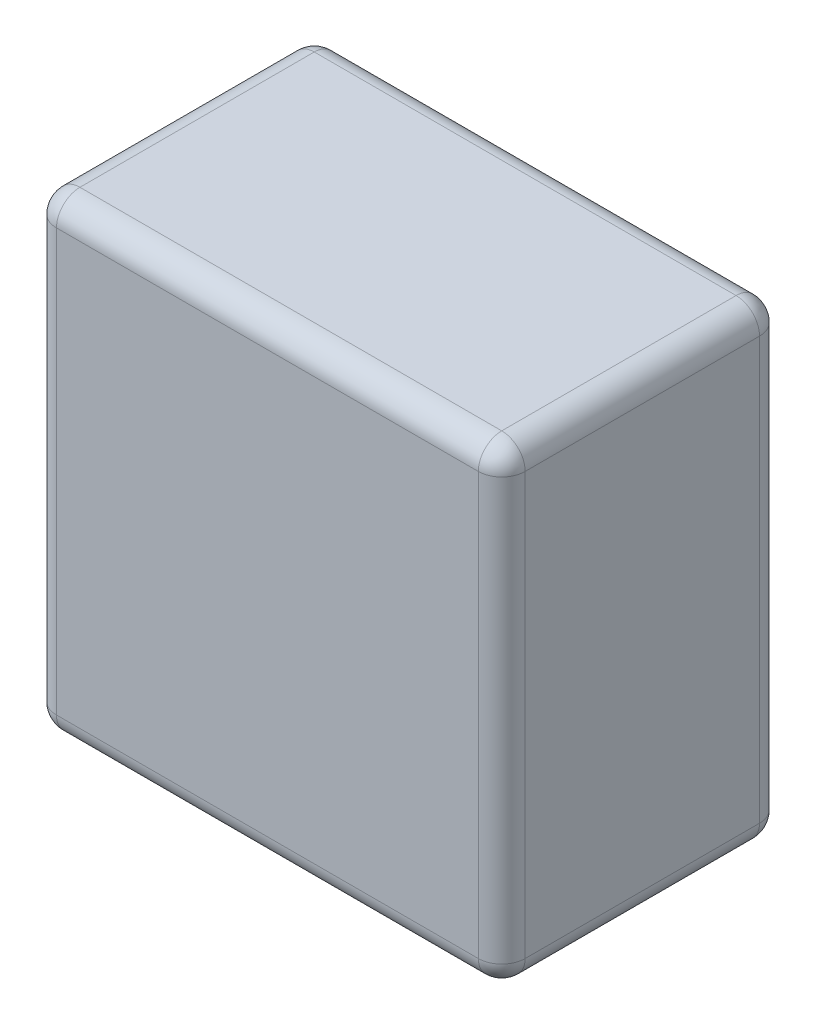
SolidWorks part; units mm, degrees
ref_plane "Front" through (0, 0, 0) normal (0, 0, 1) x (1, 0, 0)
ref_plane "Top" through (0, 0, 0) normal (0, 1, 0) x (1, 0, 0)
ref_plane "Right" through (0, 0, 0) normal (1, 0, 0) x (0, 0, -1)
sketch "Esquisse1" plane through (0, 0, 0) normal (0, 0, 1) x (1, 0, 0)
  line L4 (30, 10) -> (50, 10)
  line L5 (30, 10) -> (30, -10)
  line L6 (30, -10) -> (50, -10)
  line L7 (50, 10) -> (50, -10)
  line L8 (30, 10) -> (50, -10) construction
  line L9 (30, -10) -> (50, 10) construction
  point P1 (40, 0)
  dimension "D2" = 20
extrude "Boss.-Extru.1" add sketch "Esquisse1" along normal blind 12 contours L4 L7 L6 L5
fillet "Congé1" radius 1 12 edges at (40, -10, 0) (50, 0, 0) (40, 10, 0) (30, 0, 0) (40, 10, 12) (50, 0, 12) (40, -10, 12) (30, 0, 12) (50, -10, 6) (30, -10, 6) (50, 10, 6) (30, 10, 6)
